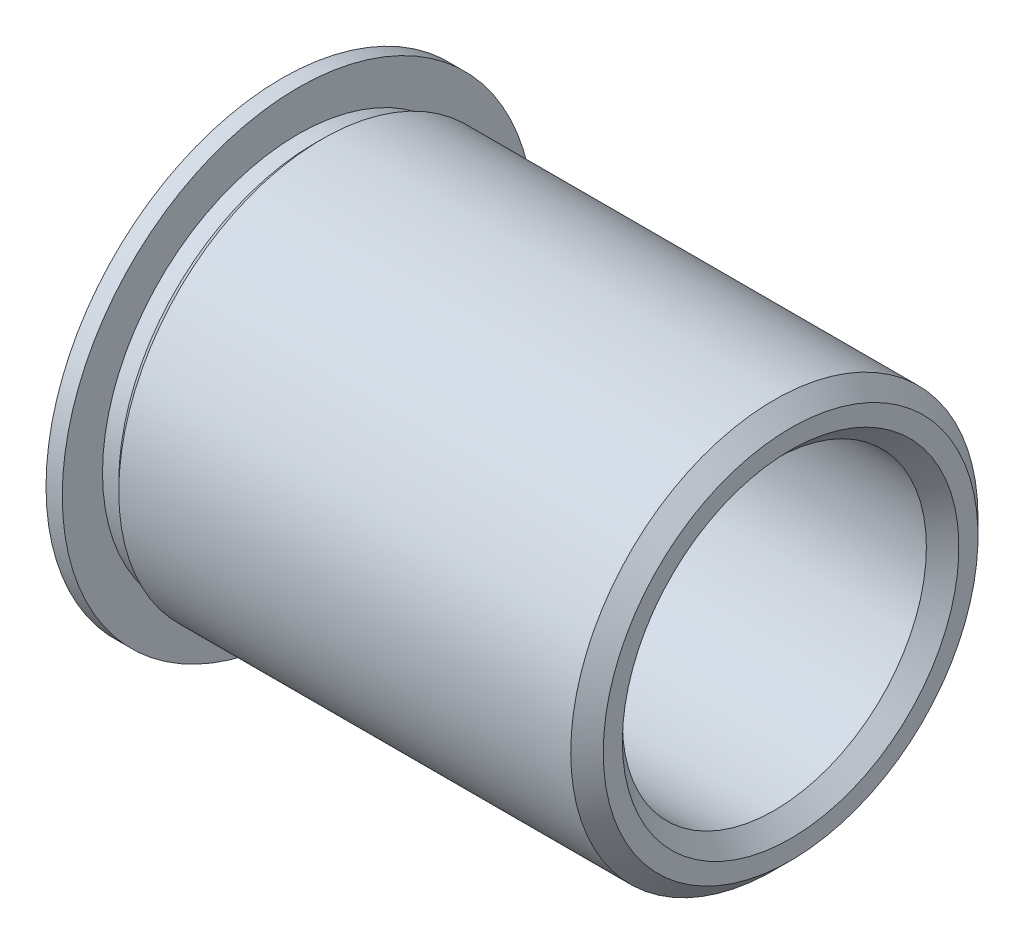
SolidWorks part; units mm, degrees
ref_plane "Front Plane" through (0, 0, 0) normal (0, 0, 1) x (1, 0, 0)
ref_plane "Top Plane" through (0, 0, 0) normal (0, 1, 0) x (1, 0, 0)
ref_plane "Right Plane" through (0, 0, 0) normal (1, 0, 0) x (0, 0, -1)
sketch "Sketch2" plane through (0, 0, 0) normal (0, 0, 1) x (1, 0, 0)
  line L0 (-53.0413, 95.4401) -> (-53.0413, 99.1231)
  line L1 (-53.0413, 99.1231) -> (-52.7873, 99.1231)
  line L2 (-53.0413, 95.4401) -> (-45.0911, 95.4401)
  line L3 (-45.0911, 95.4401) -> (-45.0911, 98.3674)
  line L4 (-45.0911, 98.3674) -> (-45.3451, 98.6214)
  line L5 (-45.3451, 98.6214) -> (-52.4063, 98.6214)
  line L6 (-52.4063, 98.6214) -> (-52.5333, 98.4944)
  line L7 (-52.5333, 98.4944) -> (-52.7873, 98.4944)
  line L8 (-52.7873, 98.4944) -> (-52.7873, 99.1231)
  dimension "D1" = 3.683
  dimension "D2" = 0.254
  dimension "D3" = 3.1813
  dimension "D4" = 0.254
  dimension "D5" = 0.254
  dimension "D6" = 7.9502
  dimension "D7" = 0.127
  dimension "D8" = 0.254
revolve "Revolve3" add sketch "Sketch2" angle 360 about L2
sketch "Sketch3" plane through (-45.0911, 0, 0) normal (1, 0, 0) x (0, 0, -1)
  circle A0 centre (0, 95.4401) radius 2.3749
  dimension "D1" = 4.7498
extrude "Cut-Extrude1" cut sketch "Sketch3" against normal through all
chamfer "Chamfer2" distance 0.254 angle 45 1 edges at (-53.0413, 95.4401, -2.3749)
chamfer "Chamfer3" distance 0.254 angle 45 1 edges at (-45.0911, 95.4401, -2.3749)
